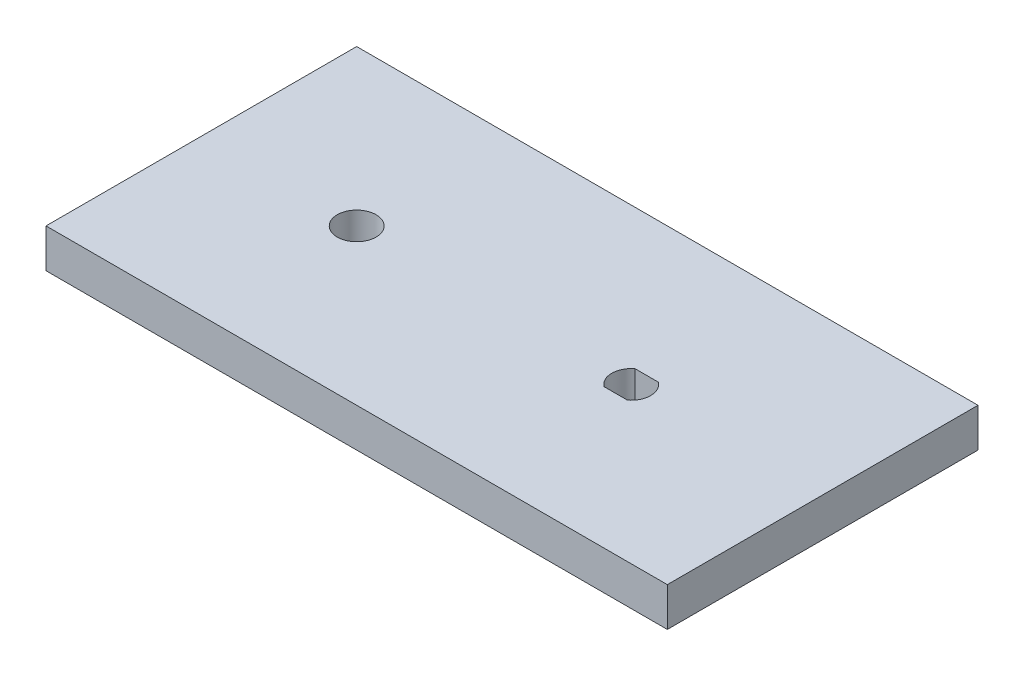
SolidWorks part; units mm, degrees
ref_plane "正面" through (0, 0, 0) normal (0, 0, 1) x (1, 0, 0)
ref_plane "平面" through (0, 0, 0) normal (0, 1, 0) x (1, 0, 0)
ref_plane "右側面" through (0, 0, 0) normal (1, 0, 0) x (0, 0, -1)
sketch "ｽｹｯﾁ1" plane through (0, 0, 0) normal (0, 1, 0) x (1, 0, 0)
  line L1 (0, 0) -> (160, 0)
  line L2 (0, 0) -> (0, 80)
  line L3 (0, 80) -> (160, 80)
  line L4 (160, 0) -> (160, 80)
  dimension "D1" = 80
  dimension "D2" = 160
extrude "押し出し1" add sketch "ｽｹｯﾁ1" along normal blind 10
sketch "ｽｹｯﾁ2" plane through (0, 10, 0) normal (0, 1, 0) x (1, 0, 0)
  line L0 (0, 80) -> (0, 0) construction
  line L1 (0, 0) -> (160, 0) construction
  circle A0 centre (40, 40) radius 5
  dimension "D1" = 10
  dimension "D2" = 40
  dimension "D3" = 40
extrude "ｶｯﾄ - 押し出し1" cut sketch "ｽｹｯﾁ2" against normal through all
sketch "ｽｹｯﾁ3" plane through (0, 10, 0) normal (0, 1, 0) x (1, 0, 0)
  line L0 (40, 40) -> (110.7, 40) construction
  line L1 (107.7, 44) -> (113.7, 44)
  line L2 (113.7, 36) -> (107.7, 36)
  arc A0 (113.7, 36) -> (113.7, 44) centre (110.7, 40) ccw
  arc A1 (107.7, 44) -> (107.7, 36) centre (110.7, 40) ccw
  dimension "D2" = 10
  dimension "D1" = 70.7
  dimension "D3" = 8
extrude "ｶｯﾄ - 押し出し2" cut sketch "ｽｹｯﾁ3" against normal through all
